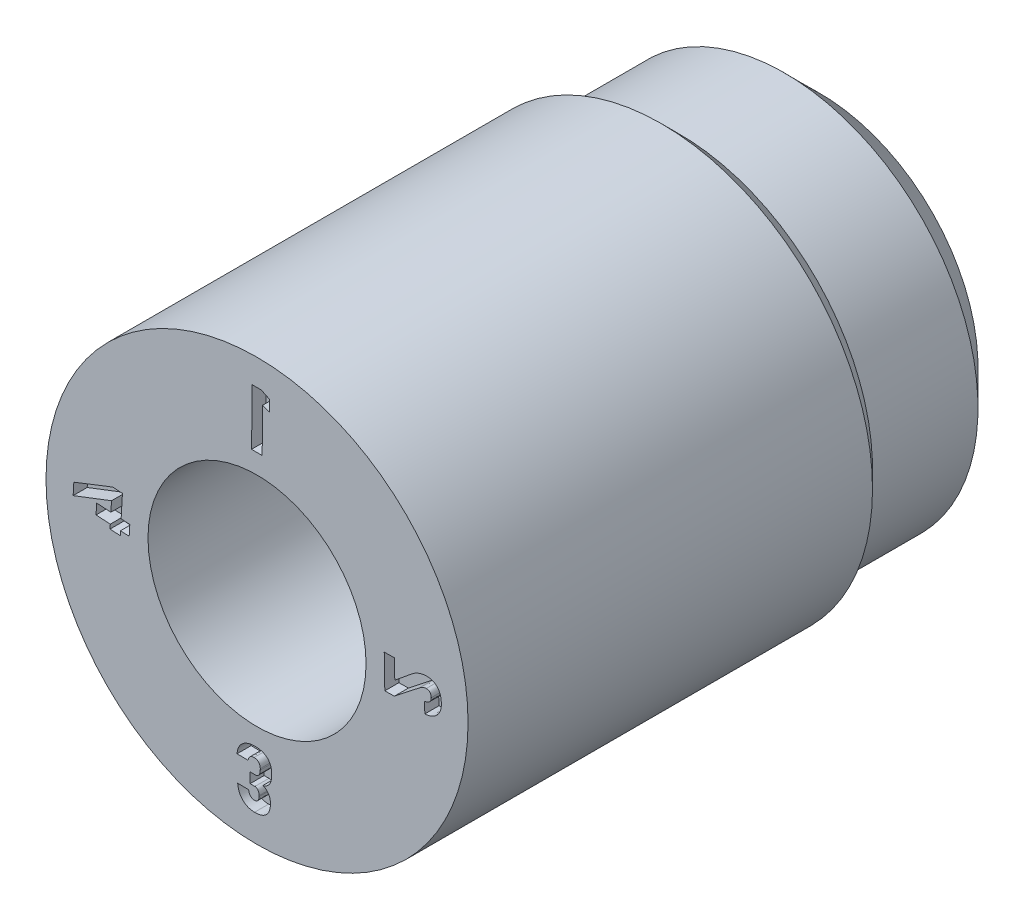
SolidWorks part; units mm, degrees
ref_plane "Front Plane" through (0, 0, 0) normal (0, 0, 1) x (1, 0, 0)
ref_plane "Top Plane" through (0, 0, 0) normal (0, 1, 0) x (1, 0, 0)
ref_plane "Right Plane" through (0, 0, 0) normal (1, 0, 0) x (0, 0, -1)
sketch "Sketch2" plane through (0, 0, 0) normal (0, 1, 0) x (1, 0, 0)
  line L0 (0, 4.8491) -> (0, -49995.1509) construction
  line L10 (2.2496, 8) -> (0.8, 8)
  line L11 (2.75, 7.4996) -> (2.2496, 8)
  line L12 (2.75, 6) -> (2.75, 7.4996)
  line L13 (3, 5.75) -> (2.75, 6)
  line L14 (3, 0) -> (3, 5.75)
  line L15 (1.55, 0) -> (3, 0)
  line L16 (1.55, 0) -> (1.55, 5.5)
  line L17 (0.8, 5.5) -> (1.55, 5.5)
  line L18 (0.8, 5.5) -> (0.8, 8)
  dimension "D1" = 6
  dimension "D2" = 3.1
  dimension "D3" = 2.5
  dimension "D4" = 1.6
  dimension "D5" = 5.5
  dimension "D6" = 8
  dimension "D7" = 45
  dimension "D8" = 45
  dimension "D9" = 2
  dimension "D10" = 0.5004
revolve "Revolve1" add sketch "Sketch2" angle 360 about L0
sketch "Sketch7" plane through (0, 0, 0) normal (0, 0, 1) x (1, 0, 0)
  line L0 (-0.0778, 1.8274) -> (0.0729, 1.8256)
  line L1 (0.0729, 1.8256) -> (0.0801, 2.4486)
  line L2 (0.0801, 2.4486) -> (0.1771, 2.4104)
  line L3 (0.1771, 2.4104) -> (0.1789, 2.5707)
  line L4 (0.1789, 2.5707) -> (0.06, 2.6258)
  line L5 (0.06, 2.6258) -> (-0.0686, 2.6274)
  line L6 (-0.0686, 2.6274) -> (-0.0778, 1.8274)
  line L7 (1.9525, -0.1974) -> (2.3088, 0.0833)
  line L8 (2.4054, 0.124) -> (2.4066, 0.124)
  line L9 (2.3831, -0.0455) -> (2.3824, -0.0455)
  line L10 (2.3824, -0.0455) -> (2.385, -0.2)
  line L11 (2.385, -0.2) -> (2.3857, -0.2)
  line L12 (2.4082, 0.2792) -> (2.4076, 0.2792)
  line L13 (2.2038, 0.2036) -> (1.9584, 0.0025)
  line L14 (1.9584, 0.0025) -> (1.9537, 0.2759)
  line L15 (1.9537, 0.2759) -> (1.8084, 0.2733)
  line L16 (1.8084, 0.2733) -> (1.8165, -0.1998)
  line L17 (1.8165, -0.1998) -> (1.9525, -0.1974)
  line L18 (-0.2835, -2.0242) -> (-0.1278, -2.0264)
  line L19 (0.046, -2.0424) -> (0.0458, -2.0612)
  line L20 (-0.0287, -2.1553) -> (-0.0964, -2.1544)
  line L21 (-0.0964, -2.1544) -> (-0.0984, -2.2997)
  line L22 (-0.0984, -2.2997) -> (-0.0308, -2.3006)
  line L23 (0.0282, -2.384) -> (0.0281, -2.3978)
  line L24 (-0.1198, -2.3843) -> (-0.275, -2.3821)
  line L25 (0.1896, -2.4152) -> (0.1898, -2.391)
  line L26 (0.2077, -2.0516) -> (0.208, -2.0275)
  line L27 (-2.0521, 0.3751) -> (-2.6043, 0.1595)
  line L28 (-2.6043, 0.1595) -> (-2.6142, -0.0112)
  line L29 (-2.6142, -0.0112) -> (-2.0689, 0.1981)
  line L30 (-2.0689, 0.1981) -> (-2.0773, 0.0524)
  line L31 (-2.0897, -0.1612) -> (-1.9444, -0.1695)
  line L32 (-1.9444, -0.1695) -> (-1.9408, -0.1068)
  line L33 (-1.9135, 0.3671) -> (-2.0521, 0.3751)
  line L34 (-2.2797, 0.0641) -> (-2.2885, -0.0867)
  line L35 (-2.2885, -0.0867) -> (-2.086, -0.0984)
  line L36 (-1.8175, -0.1139) -> (-1.8087, 0.0369)
  line L37 (-1.8087, 0.0369) -> (-1.9321, 0.044)
  line L38 (-2.0773, 0.0524) -> (-2.2797, 0.0641)
  line L39 (-1.9408, -0.1068) -> (-1.8175, -0.1139)
  line L40 (-2.086, -0.0984) -> (-2.0897, -0.1612)
  line L41 (-1.9321, 0.044) -> (-1.9135, 0.3671)
  arc A0 (-0.1658, 1.8285) -> (-0.5609, 1.7482) centre (0, 0) cw construction
  circle A54 centre (0, 0) radius 3 construction
  spline S0 degree 3 poles (2.3088, 0.0833) (2.3238, 0.0953) (2.3441, 0.1081) (2.3702, 0.1178) (2.3859, 0.1223) (2.3978, 0.1237) (2.4054, 0.124) knots 0 0 0 0 0.540916 0.666679 0.78317 1 1 1 1
  spline S1 degree 3 poles (2.4066, 0.124) (2.4164, 0.1243) (2.4308, 0.1222) (2.4474, 0.1133) (2.4574, 0.1041) (2.4653, 0.0924) (2.4737, 0.0729) (2.4751, 0.0562) (2.4756, 0.0449) knots 0 0 0 0 0.247208 0.35828 0.469621 0.586603 0.711445 1 1 1 1
  spline S2 degree 3 poles (2.4756, 0.0449) (2.4758, 0.0334) (2.4735, 0.0162) (2.463, -0.0038) (2.4523, -0.0165) (2.4388, -0.0274) (2.4161, -0.0391) (2.3967, -0.0439) (2.3831, -0.0455) knots 0 0 0 0 0.241139 0.3537 0.468068 0.587476 0.712596 1 1 1 1
  spline S3 degree 3 poles (2.3857, -0.2) (2.4091, -0.1982) (2.4433, -0.1921) (2.4857, -0.177) (2.5137, -0.1624) (2.5389, -0.145) (2.5611, -0.125) (2.5798, -0.1019) (2.5953, -0.0765) (2.6072, -0.0486) (2.6188, -0.0079) (2.6213, 0.0244) (2.6209, 0.0463) knots 0 0 0 0 0.185637 0.271684 0.35429 0.434282 0.512411 0.589241 0.667204 0.746366 0.8274 1 1 1 1
  spline S4 degree 3 poles (2.6209, 0.0463) (2.6202, 0.0695) (2.6174, 0.1034) (2.6061, 0.1457) (2.5949, 0.1736) (2.5807, 0.1984) (2.564, 0.2204) (2.5441, 0.2388) (2.5218, 0.2542) (2.4966, 0.2659) (2.459, 0.2772) (2.4288, 0.2795) (2.4082, 0.2792) knots 0 0 0 0 0.19463 0.282982 0.366381 0.445603 0.521925 0.596615 0.671833 0.7486 0.827501 1 1 1 1
  spline S5 degree 3 poles (2.4076, 0.2792) (2.3894, 0.279) (2.3621, 0.2761) (2.3263, 0.2674) (2.2997, 0.2587) (2.2738, 0.248) (2.241, 0.2308) (2.2181, 0.2153) (2.2038, 0.2036) knots 0 0 0 0 0.246243 0.371119 0.498467 0.626038 0.75097 1 1 1 1
  spline S6 degree 3 poles (-0.0241, -1.8037) (-0.047, -1.8036) (-0.0811, -1.8056) (-0.1241, -1.8166) (-0.1537, -1.8277) (-0.181, -1.842) (-0.2055, -1.8596) (-0.2269, -1.8804) (-0.2456, -1.9039) (-0.2607, -1.9304) (-0.277, -1.9699) (-0.2818, -2.0023) (-0.2835, -2.0242) knots 0 0 0 0 0.181186 0.26664 0.349466 0.430033 0.508613 0.586173 0.664837 0.744783 0.826271 1 1 1 1
  spline S7 degree 3 poles (-0.1278, -2.0264) (-0.1265, -2.0187) (-0.1241, -2.0074) (-0.1181, -1.9936) (-0.1128, -1.9846) (-0.1066, -1.9764) (-0.0997, -1.9693) (-0.0918, -1.9634) (-0.0834, -1.9583) (-0.0742, -1.9543) (-0.0605, -1.9507) (-0.0498, -1.9495) (-0.0425, -1.9498) knots 0 0 0 0 0.186129 0.272234 0.354677 0.434033 0.513317 0.589353 0.666902 0.746425 0.827109 1 1 1 1
  spline S8 degree 3 poles (-0.0425, -1.9498) (-0.0297, -1.9501) (-0.0108, -1.9525) (0.011, -1.9634) (0.024, -1.9744) (0.0343, -1.9879) (0.0439, -2.0105) (0.0464, -2.0294) (0.046, -2.0424) knots 0 0 0 0 0.265854 0.383628 0.498411 0.613194 0.730968 1 1 1 1
  spline S9 degree 3 poles (0.0458, -2.0612) (0.0455, -2.0747) (0.0436, -2.0943) (0.0351, -2.1176) (0.0265, -2.1314) (0.0157, -2.1423) (-0.0022, -2.153) (-0.0181, -2.1555) (-0.0287, -2.1553) knots 0 0 0 0 0.299739 0.427977 0.545252 0.656409 0.764248 1 1 1 1
  spline S10 degree 3 poles (-0.0308, -2.3006) (-0.022, -2.3004) (-0.0091, -2.3034) (0.0053, -2.3131) (0.0139, -2.3231) (0.0206, -2.3353) (0.0271, -2.3556) (0.0286, -2.3723) (0.0282, -2.384) knots 0 0 0 0 0.227255 0.334903 0.447139 0.567132 0.696605 1 1 1 1
  spline S11 degree 3 poles (0.0281, -2.3978) (0.0279, -2.4088) (0.0258, -2.4246) (0.0182, -2.4435) (0.0103, -2.4546) (0.0004, -2.4634) (-0.0157, -2.4719) (-0.0297, -2.4739) (-0.0391, -2.4737) knots 0 0 0 0 0.286764 0.411667 0.528163 0.640614 0.753082 1 1 1 1
  spline S12 degree 3 poles (-0.0391, -2.4737) (-0.0457, -2.4736) (-0.0556, -2.4725) (-0.0676, -2.4676) (-0.0762, -2.463) (-0.0842, -2.457) (-0.0917, -2.4499) (-0.0982, -2.4416) (-0.1043, -2.4322) (-0.1095, -2.4216) (-0.1156, -2.4058) (-0.1182, -2.393) (-0.1198, -2.3843) knots 0 0 0 0 0.150011 0.222512 0.2962 0.371809 0.448976 0.529871 0.61371 0.70349 0.797355 1 1 1 1
  spline S13 degree 3 poles (-0.275, -2.3821) (-0.2734, -2.4052) (-0.2674, -2.4389) (-0.2527, -2.481) (-0.238, -2.509) (-0.2208, -2.5343) (-0.2009, -2.5567) (-0.1783, -2.5757) (-0.1533, -2.5917) (-0.1261, -2.604) (-0.0872, -2.6164) (-0.0564, -2.6201) (-0.0355, -2.6203) knots 0 0 0 0 0.18551 0.272283 0.356206 0.437835 0.516629 0.595241 0.673883 0.753403 0.833124 1 1 1 1
  spline S14 degree 3 poles (-0.0355, -2.6203) (-0.0188, -2.6207) (0.0057, -2.6192) (0.0371, -2.6141) (0.0586, -2.6085) (0.0785, -2.6009) (0.0971, -2.592) (0.114, -2.581) (0.1296, -2.5686) (0.1433, -2.5543) (0.1556, -2.5388) (0.166, -2.5217) (0.1741, -2.5031) (0.181, -2.4832) (0.1873, -2.4539) (0.1893, -2.4309) (0.1896, -2.4152) knots 0 0 0 0 0.145069 0.21171 0.275454 0.336893 0.395836 0.453793 0.511223 0.568178 0.625032 0.681948 0.740597 0.800736 0.864053 1 1 1 1
  spline S15 degree 3 poles (0.1898, -2.391) (0.1901, -2.3735) (0.1872, -2.3476) (0.1758, -2.3154) (0.1637, -2.2936) (0.1482, -2.2741) (0.1234, -2.2504) (0.1003, -2.2379) (0.0842, -2.2311) knots 0 0 0 0 0.256895 0.378293 0.499432 0.620592 0.742541 1 1 1 1
  spline S16 degree 3 poles (0.0842, -2.2311) (0.0935, -2.2291) (0.107, -2.2249) (0.124, -2.2173) (0.1357, -2.2102) (0.1467, -2.2023) (0.1568, -2.1931) (0.1662, -2.1831) (0.1747, -2.1718) (0.182, -2.1596) (0.1889, -2.1467) (0.1944, -2.1328) (0.199, -2.1181) (0.2027, -2.1027) (0.2063, -2.0805) (0.2075, -2.0633) (0.2077, -2.0516) knots 0 0 0 0 0.120546 0.178653 0.23549 0.292828 0.34972 0.407664 0.466799 0.527168 0.58835 0.651429 0.715828 0.782566 0.85198 1 1 1 1
  spline S17 degree 3 poles (0.208, -2.0275) (0.2084, -2.0057) (0.2056, -1.9739) (0.1947, -1.934) (0.1829, -1.9077) (0.1677, -1.8841) (0.1494, -1.863) (0.1274, -1.8455) (0.1027, -1.8306) (0.0748, -1.8188) (0.0327, -1.807) (-0.001, -1.804) (-0.0241, -1.8037) knots 0 0 0 0 0.178128 0.259598 0.337592 0.413473 0.488705 0.564513 0.642809 0.724671 0.810985 1 1 1 1
extrude "Cut-Extrude1" cut sketch "Sketch7" against normal blind 0.2
